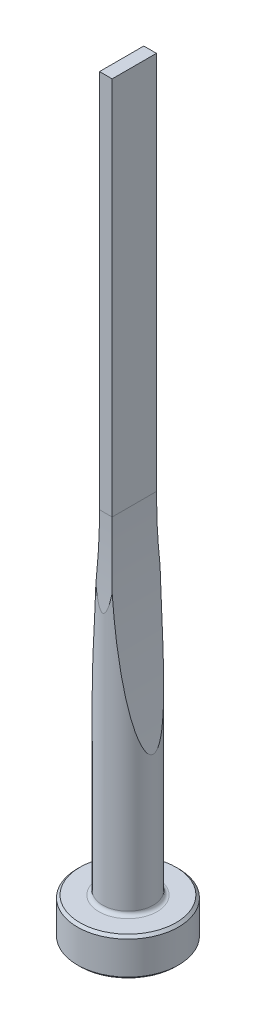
SolidWorks part; units mm, degrees
ref_plane "Front Plane" through (0, 0, 0) normal (0, 0, 1) x (1, 0, 0)
ref_plane "Top Plane" through (0, 0, 0) normal (0, 1, 0) x (1, 0, 0)
ref_plane "Right Plane" through (0, 0, 0) normal (1, 0, 0) x (0, 0, -1)
sketch "Sketch1" plane through (0, 0, 0) normal (0, 0, 1) x (1, 0, 0)
  line L0 (0, 0) -> (3.8, 0)
  line L1 (55, 0) -> (-55, 0) construction
  line L2 (4, 0.2) -> (4, 2.8)
  line L3 (3.8, 3) -> (2.3, 3)
  line L4 (2, 3.3) -> (2, 60)
  line L5 (0, 60) -> (2, 60)
  line L6 (4, 2.8) -> (3.8, 3)
  line L7 (3.8, 0) -> (4, 0.2)
  line L8 (0, 60) -> (0, 0)
  arc A0 (2, 3.3) -> (2.3, 3) centre (2.3, 3.3) ccw
  point P1 (4, 0)
  point P6 (4, 3)
  dimension "D4" = 0.3
  dimension "D1" = 2
  dimension "D2" = 4
  dimension "D3" = 3
  dimension "D5" = 60
revolve "Revolve1" add sketch "Sketch1" angle 360 about L8
sketch "Sketch2" plane through (0, 0, 0) normal (0, 0, 1) x (1, 0, 0)
  line L0 (0.5, 60) -> (0.5, 30)
  line L1 (2, 60) -> (-2, 60) construction
  line L2 (-0.5, 60) -> (-0.5, 30)
  line L3 (2, 60) -> (2, 13.6369)
  line L4 (-2, 60) -> (-2, 13.6369)
  line L5 (0, -4.4) -> (0, 4.4) construction
  line L6 (2, 60) -> (0.5, 60)
  line L8 (-0.5, 60) -> (-2, 60)
  arc A0 (0.5, 30) -> (2, 13.6369) centre (90.5, 30) ccw
  arc A1 (-0.5, 30) -> (-2, 13.6369) centre (-90.5, 30) cw
  dimension "D4" = 90
  dimension "D1" = 30
  dimension "D2" = 1
  dimension "D3" = 0.5
extrude "Cut-Extrude1" cut sketch "Sketch2" against normal mid plane 10
sketch "Sketch3" plane through (0, 0, 0) normal (1, 0, 0) x (0, 0, -1)
  line L0 (1.75, 60) -> (1.75, 30)
  line L1 (-1.9365, 60) -> (1.9365, 60) construction
  line L2 (-1.75, 60) -> (-1.75, 30)
  line L3 (2, 60) -> (2, 23.2965)
  line L4 (1.75, 60) -> (2, 60)
  line L5 (0, 4.4) -> (0, -4.4) construction
  line L6 (-2, 60) -> (-2, 23.2965)
  line L8 (-1.75, 60) -> (-2, 60)
  arc A0 (1.75, 30) -> (2, 23.2965) centre (91.75, 30) ccw
  arc A1 (-1.75, 30) -> (-2, 23.2965) centre (-91.75, 30) cw
  dimension "D2" = 90
  dimension "D1" = 30
  dimension "D3" = 3.5
  dimension "D4" = 1.75
extrude "Cut-Extrude2" cut sketch "Sketch3" against normal mid plane 10
